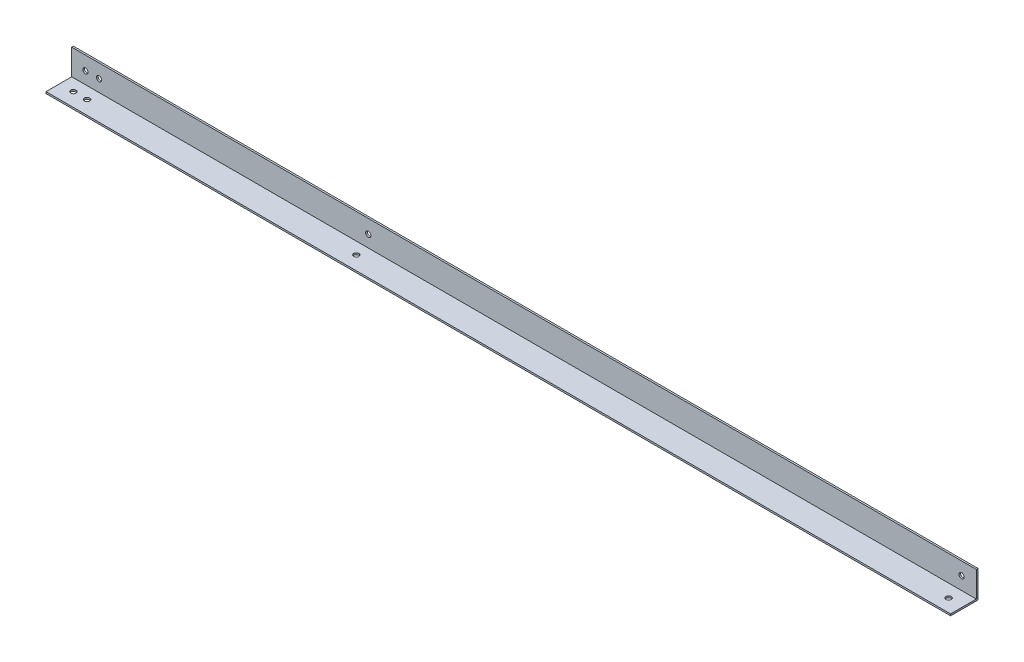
SolidWorks part; units mm, degrees
ref_plane "Front Plane" through (0, 0, 0) normal (1, 0, 0) x (0, 1, 0)
ref_plane "Top Plane" through (0, 0, 0) normal (0, 0, 1) x (0, 1, 0)
ref_plane "Right Plane" through (0, 0, 0) normal (0, 1, 0) x (-1, 0, 0)
sketch "Sketch1" plane through (0, 0, 0) normal (1, 0, 0) x (0, 1, 0)
  line L0 (0, 0) -> (25.4, 0)
  line L1 (0, 0) -> (0, 25.4)
  line L2 (1.5875, 1.5875) -> (1.5875, 25.4)
  line L3 (1.5875, 1.5875) -> (25.4, 1.5875)
  line L4 (25.4, 0) -> (25.4, 1.5875)
  line L5 (0, 25.4) -> (1.5875, 25.4)
  dimension "D1" = 25.4
  dimension "D2" = 1.5875
extrude "Boss-Extrude1" add sketch "Sketch1" along normal mid plane 838.2
sketch "Sketch2" plane through (0, 0, 0) normal (0, 1, 0) x (-1, 0, 0)
  line L0 (-419.1, 1.5875) -> (-419.1, 25.4) construction
  line L1 (-419.1, 25.4) -> (419.1, 25.4) construction
  line L2 (419.1, 1.5875) -> (419.1, 25.4) construction
  circle A0 centre (-405.3836, 13.4937) radius 2.4257
  circle A1 centre (393.7, 12.7) radius 2.4257
  circle A2 centre (144.2771, 12.7) radius 2.4257
  circle A3 centre (406.4, 12.7) radius 2.4257
  point P4 (-419.1, 13.4937)
  dimension "D1" = 4.8514
  dimension "D2" = 25.4
  dimension "D4" = 4.8514
  dimension "D6" = 12.7
  dimension "D7" = 12.7
  dimension "D3" = 799.084
  dimension "D5" = 249.4229
extrude "Cut-Extrude1" cut sketch "Sketch2" along normal through all
ref_plane "Plane1" through (0, 0, 0) normal (0, 0.7071, -0.7071) x (0, 0.7071, 0.7071)
mirror "Mirror1" about plane through (0, 0, 0) normal (0, 0.7071, -0.7071) of "Cut-Extrude1"
equation "\"fdia\"=0.28125"
